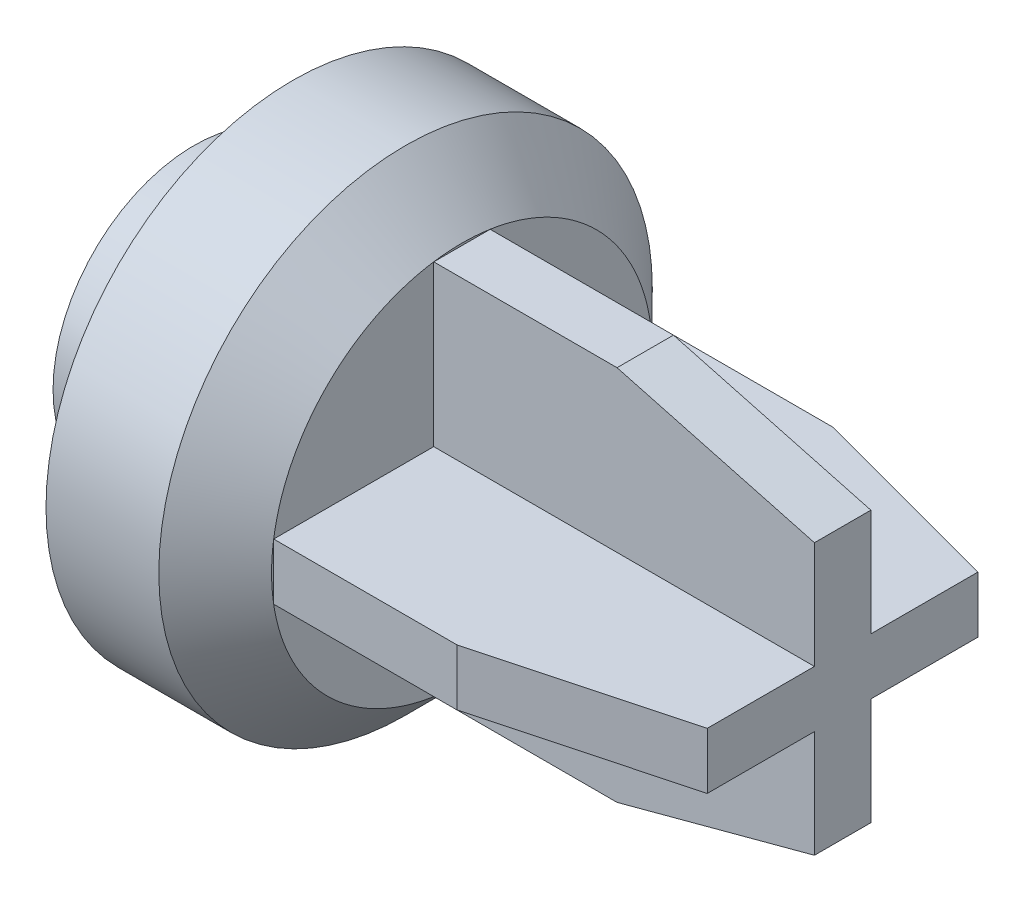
SolidWorks part; units mm, degrees
ref_plane "Plan de face" through (0, 0, 0) normal (0, 0, 1) x (1, 0, 0)
ref_plane "Plan de dessus" through (0, 0, 0) normal (0, 1, 0) x (1, 0, 0)
ref_plane "Plan de droite" through (0, 0, 0) normal (1, 0, 0) x (0, 0, -1)
sketch "Esquisse1" plane through (0, 0, 0) normal (0, 0, 1) x (1, 0, 0)
  line L0 (0, 0) -> (20.4648, 0) construction
  line L1 (-3.5, 8.75) -> (0.5, 8.75)
  line L2 (0.5, 8.75) -> (2.5, 6.75)
  line L3 (2.5, 6.75) -> (2.5, 0)
  line L4 (-3.5, 8.75) -> (-3.5, 6.75)
  line L5 (-3.5, 6.75) -> (-0.5, 6.75)
  line L6 (-0.5, 6.75) -> (-0.5, 5.34)
  line L7 (-0.5, 5.34) -> (-7, 5)
  line L8 (-7, 5) -> (-7, 3.5)
  line L9 (-7, 3.5) -> (0, 3.875)
  line L10 (0, 3.875) -> (0, 0)
  line L11 (0, 0) -> (2.5, 0)
  dimension "D1" = 17.5
  dimension "D2" = 4
  dimension "D3" = 45
  dimension "D4" = 2
  dimension "D5" = 13.5
  dimension "D6" = 3
  dimension "D7" = 10.68
  dimension "D8" = 10
  dimension "D9" = 7.75
  dimension "D10" = 7
  dimension "D11" = 6.5
  dimension "D12" = 7
revolve "Révolution1" add sketch "Esquisse1" angle 360 about L0
sketch "Esquisse2" plane through (0, 0, 0) normal (0, 0, 1) x (1, 0, 0)
  line L0 (2.5, -6.75) -> (2.5, 6.75) construction
  line L1 (2.5, 6.675) -> (9, 6.675)
  line L2 (2.5, 6.675) -> (2.5, -6.675)
  line L3 (2.5, -6.675) -> (9, -6.675)
  line L5 (9, 6.675) -> (16, 4.8)
  line L6 (16, 4.8) -> (16, -4.8)
  line L7 (16, -4.8) -> (9, -6.675)
  dimension "D1" = 13.35
  dimension "D2" = 6.675
  dimension "D3" = 9.6
  dimension "D4" = 4.8
  dimension "D5" = 7
  dimension "D6" = 6.5
  dimension "D7" = 7
extrude "Boss.-Extru.1" add sketch "Esquisse2" along normal mid plane 2
pattern_circular "Répétition circulaire1" count 2 every 90 about axis through (0, 0, 0) along (1, 0, 0) of "Révolution1", "Boss.-Extru.1"
